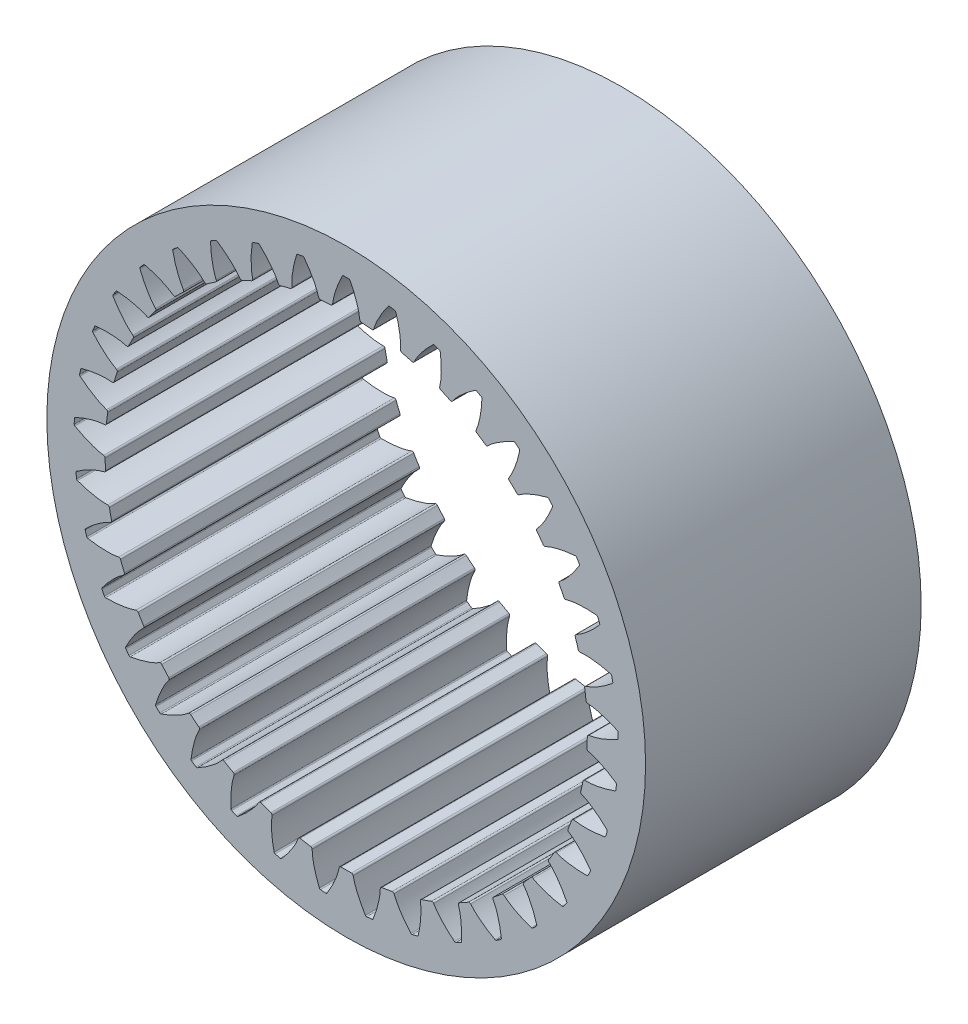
SolidWorks part; units mm, degrees
ref_plane "Front Plane" through (0, 0, 0) normal (0, 0, 1) x (1, 0, 0)
ref_plane "Top Plane" through (0, 0, 0) normal (0, 1, 0) x (1, 0, 0)
ref_plane "Right Plane" through (0, 0, 0) normal (1, 0, 0) x (0, 0, -1)
sketch "Sketch5" plane through (0, 0, 0) normal (0, 0, 1) x (1, 0, 0)
  circle A0 centre (0, 0) radius 13.7954
  circle A1 centre (0, 0) radius 11.1125
  dimension "Ring Gear OD" = 27.5908
  dimension "Ring Gear ID" = 22.225
extrude "Ring Gear Blank" add sketch "Sketch5" along normal mid plane 12.7
ref_axis "Axis-Ring Gear" through (0, 0, 6.35) along (0, 0, -1)
sketch "Sketch2" plane through (0, 0, 0) normal (0, 0, 1) x (1, 0, 0)
  line L0 (0, 0) -> (-0.6328, 11.0209) construction
  line L1 (0, 12.5412) -> (0, 11.7475) construction
  line L2 (0, 11.7475) -> (0, 11.1125) construction
  line L3 (-0.6328, 11.0209) -> (-0.6284, 11.1354) construction
  line L4 (-0.6284, 11.1354) -> (-0.6149, 11.2492) construction
  line L5 (-0.6149, 11.2492) -> (-0.5955, 11.3621) construction
  line L6 (-0.5955, 11.3621) -> (-0.5714, 11.4741) construction
  line L7 (-0.5714, 11.4741) -> (-0.5432, 11.5852) construction
  line L8 (-0.5432, 11.5852) -> (-0.5115, 11.6953) construction
  line L9 (0.9567, 10.9975) -> (-0.6284, 11.1354) construction
  line L10 (1.6109, 10.9209) -> (-0.6149, 11.2492) construction
  line L11 (2.1091, 10.8357) -> (-0.5955, 11.3621) construction
  line L12 (2.5258, 10.7462) -> (-0.5714, 11.4741) construction
  line L13 (2.8897, 10.6541) -> (-0.5432, 11.5852) construction
  line L14 (3.2159, 10.5602) -> (-0.5115, 11.6953) construction
  line L15 (0, 0) -> (-0.3353, 7.8942) construction
  line L16 (-0.5115, 11.6953) -> (-0.4765, 11.8045) construction
  line L17 (-0.4765, 11.8045) -> (-0.4386, 11.9126) construction
  line L18 (-0.4386, 11.9126) -> (-0.398, 12.0198) construction
  line L19 (-0.398, 12.0198) -> (-0.3548, 12.1259) construction
  line L20 (-0.3548, 12.1259) -> (-0.3091, 12.231) construction
  line L21 (-0.3091, 12.231) -> (-0.2612, 12.3351) construction
  line L22 (-0.2612, 12.3351) -> (-0.2112, 12.4382) construction
  line L23 (-0.2112, 12.4382) -> (-0.1591, 12.5402) construction
  line L24 (-0.4765, 11.8045) -> (3.5132, 10.4651) construction
  line L25 (-0.4386, 11.9126) -> (3.7874, 10.369) construction
  line L26 (-0.398, 12.0198) -> (4.0426, 10.2722) construction
  line L27 (-0.3548, 12.1259) -> (4.2816, 10.1749) construction
  line L28 (-0.3091, 12.231) -> (4.5068, 10.0771) construction
  line L29 (-0.2612, 12.3351) -> (4.7199, 9.9791) construction
  line L30 (-0.2112, 12.4382) -> (4.9223, 9.8809) construction
  line L31 (-0.1591, 12.5402) -> (5.1151, 9.7824) construction
  line L32 (0.011, 13.3464) -> (-1.0081, 10.1275) construction
  line L33 (-0.6328, 11.0209) -> (-0.6263, 10.9065) construction
  line L34 (-0.6263, 10.9065) -> (-0.6197, 10.7921) construction
  line L35 (-0.6197, 10.7921) -> (-0.6131, 10.6777) construction
  line L36 (-0.6131, 10.6777) -> (-0.6066, 10.5633) construction
  line L37 (-0.6066, 10.5633) -> (-0.6, 10.4489) construction
  line L38 (-0.6, 10.4489) -> (-0.5934, 10.3345) construction
  arc A0 (-0.6328, 11.0209) -> (3.5132, 10.4651) centre (0, 0) cw construction
  arc A1 (3.7874, 10.369) -> (-0.6328, 11.0209) centre (0, 0) ccw construction
  circle A2 centre (0, 0) radius 11.039 construction
  circle A3 centre (0, 0) radius 11.1125 construction
  arc A4 (-0.6328, 11.0209) -> (4.0426, 10.2722) centre (0, 0) cw construction
  arc A5 (-0.6328, 11.0209) -> (0.9567, 10.9975) centre (0, 0) cw construction
  arc A6 (1.6109, 10.9209) -> (-0.6328, 11.0209) centre (0, 0) ccw construction
  arc A7 (2.1091, 10.8357) -> (-0.6328, 11.0209) centre (0, 0) ccw construction
  arc A8 (2.5258, 10.7462) -> (-0.6328, 11.0209) centre (0, 0) ccw construction
  arc A9 (-0.6328, 11.0209) -> (2.8897, 10.6541) centre (0, 0) cw construction
  arc A10 (-0.6328, 11.0209) -> (3.2159, 10.5602) centre (0, 0) cw construction
  arc A11 (-0.6328, 11.0209) -> (4.2816, 10.1749) centre (0, 0) cw construction
  arc A12 (4.5068, 10.0771) -> (-0.6328, 11.0209) centre (0, 0) ccw construction
  arc A13 (4.7199, 9.9791) -> (-0.6328, 11.0209) centre (0, 0) ccw construction
  arc A14 (-0.6328, 11.0209) -> (4.9223, 9.8809) centre (0, 0) cw construction
  arc A15 (-0.6328, 11.0209) -> (5.1151, 9.7824) centre (0, 0) cw construction
  circle A16 centre (0, 0) radius 11.7475 construction
  circle A17 centre (0, 0) radius 12.5413 construction
  arc A18 (-0.4986, 11.7369) -> (0.4986, 11.7369) centre (0, 0) cw construction
  arc A19 (0.1591, 12.5402) -> (-0.1591, 12.5402) centre (0, 0) ccw
  arc A20 (0.3164, 5.5104) -> (-0.3164, 5.5104) centre (0, 0) cw
  spline S0 degree 3 poles (-0.1591, 12.5402) (-0.1945, 12.4725) (-0.2456, 12.37) (-0.3095, 12.2312) (-0.3552, 12.1261) (-0.3984, 12.0199) (-0.4391, 11.9128) (-0.477, 11.8046) (-0.512, 11.6955) (-0.5438, 11.5854) (-0.572, 11.4743) (-0.5963, 11.3623) (-0.6158, 11.2493) (-0.6298, 11.1356) (-0.6354, 11.0208) (-0.6256, 10.9065) (-0.6199, 10.7921) (-0.6131, 10.6777) (-0.6066, 10.5633) (-0.5074, 8.8409) (-0.4156, 7.1565) (-0.3164, 5.5104) knots 0 0 0 0 0.032172 0.048257 0.064343 0.080429 0.096515 0.112601 0.128686 0.144772 0.160858 0.176944 0.19303 0.209115 0.225201 0.241287 0.257373 0.273459 0.289545 0.30563 1 1 1 1
  spline S1 degree 3 poles (0.1591, 12.5402) (0.1945, 12.4725) (0.2456, 12.37) (0.3095, 12.2312) (0.3552, 12.1261) (0.3984, 12.0199) (0.4391, 11.9128) (0.477, 11.8046) (0.512, 11.6955) (0.5438, 11.5854) (0.572, 11.4743) (0.5963, 11.3623) (0.6158, 11.2493) (0.6298, 11.1356) (0.6354, 11.0208) (0.6256, 10.9065) (0.6199, 10.7921) (0.6131, 10.6777) (0.6066, 10.5633) (0.5074, 8.8409) (0.4156, 7.1565) (0.3164, 5.5104) knots 0 0 0 0 0.032172 0.048257 0.064343 0.080429 0.096515 0.112601 0.128686 0.144772 0.160858 0.176944 0.19303 0.209115 0.225201 0.241287 0.257373 0.273459 0.289545 0.30563 1 1 1 1
  point P8 (-0.6328, 11.0209)
  point P44 (-0.4986, 11.7369)
  dimension "Pitch Dia" = 23.495
  dimension "Base Circle" = 22.0781
  dimension "Root_Diameter" = 22.225
  dimension "Outside_Diameter" = 25.0825
  dimension "Addendum" = 0.635
  dimension "PressAngle_Measured" = 20
  dimension "Dedendum" = 0.7937
  dimension "Tooth_Depth" = 1.4287
  dimension "Tooth Width" = 0.9975
extrude "First Tooth" cut sketch "Sketch2" against normal through all both and the other way through all
fillet "Tip Radius" radius 0.0794 2 edges at (-0.6313, 11.0946, 0) (0.6313, 11.0946, 0)
fillet "Root Fillet" radius 0.0635 2 edges at (-0.1591, 12.5402, 0) (0.1591, 12.5402, 0)
pattern_circular "Teeth" count 37 over 360 about axis through (0, 0, 6.35) along (0, 0, -1) of "First Tooth", "Tip Radius", "Root Fillet"
